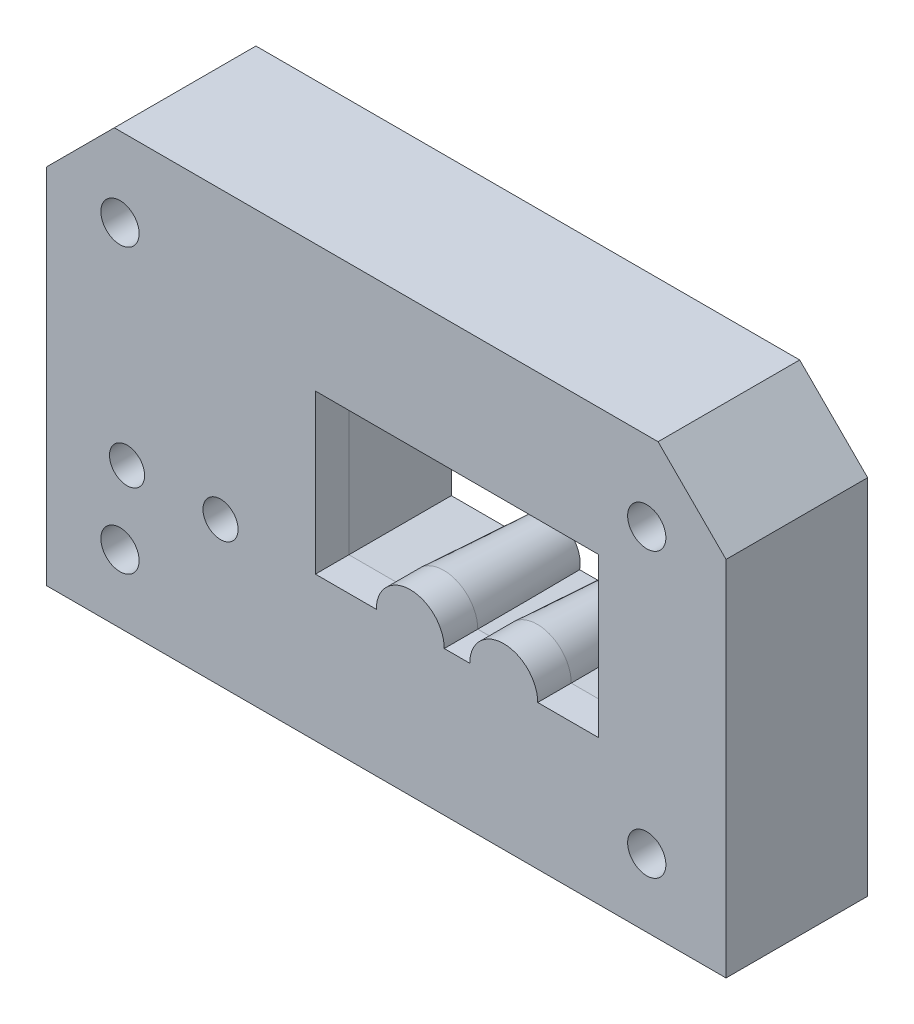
SolidWorks part; units mm, degrees
ref_plane "Face" through (0, 0, 0) normal (0, 0, 1) x (1, 0, 0)
ref_plane "Dessus" through (0, 0, 0) normal (0, 1, 0) x (1, 0, 0)
ref_plane "Droite" through (0, 0, 0) normal (1, 0, 0) x (0, 0, -1)
sketch "Esquisse1" plane through (0, 0, 0) normal (0, 0, 1) x (1, 0, 0)
  line L0 (313, 199) -> (217, 199) construction
  line L1 (325, 199) -> (205, 199)
  line L2 (325, 18) -> (325, 187) construction
  line L3 (325, 123) -> (325, 199)
  line L4 (325, 123) -> (205, 123)
  line L5 (205, 123) -> (205, 199)
  line L6 (263.25, 148.5) -> (241.75, 148.5) construction
  line L7 (279.75, 148.5) -> (275.25, 148.5) construction
  line L8 (302.5, 157.5) -> (302.5, 148.5) construction
  line L9 (302.5, 148.5) -> (291.75, 148.5) construction
  line L10 (263.25, 148.5) -> (252.5, 148.5)
  line L11 (279.75, 148.5) -> (275.25, 148.5)
  line L12 (302.5, 176.5) -> (302.5, 148.5)
  line L13 (302.5, 148.5) -> (291.75, 148.5)
  line L14 (302.5, 176.5) -> (252.5, 176.5)
  line L15 (252.5, 176.5) -> (252.5, 148.5)
  arc A0 (275.25, 148.5) -> (263.25, 148.5) centre (269.25, 148.5) ccw construction
  arc A1 (291.75, 148.5) -> (279.75, 148.5) centre (285.75, 148.5) ccw construction
  arc A2 (275.25, 148.5) -> (263.25, 148.5) centre (269.25, 148.5) ccw
  arc A3 (291.75, 148.5) -> (279.75, 148.5) centre (285.75, 148.5) ccw
  circle A4 centre (219.25, 148.5) radius 3.1
  circle A5 centre (235.75, 148.5) radius 3.1
  dimension "D5" = 6.2
  dimension "D6" = 6.2
  dimension "D8" = 16.75
  dimension "D1" = 76
  dimension "D2" = 120
  dimension "D3" = 28
  dimension "D4" = 50
  dimension "D7" = 22.5
extrude "Base-Extrusion" add sketch "Esquisse1" along normal blind 25
chamfer "Chanfrein1" distance 12 angle 45 2 edges at (205, 199, 12.5) (325, 199, 12.5)
sketch "Esquisse2" plane through (0, 0, 0) normal (0, 0, -1) x (-1, 0, 0)
  line L12 (-264.351, 147.5) -> (-251.5, 147.5)
  line L13 (-280.851, 147.5) -> (-274.149, 147.5)
  line L14 (-303.5, 147.5) -> (-290.649, 147.5)
  line L15 (-303.5, 177.5) -> (-303.5, 147.5)
  line L16 (-251.5, 177.5) -> (-303.5, 177.5)
  line L17 (-251.5, 147.5) -> (-251.5, 177.5)
  line L18 (-264.351, 147.5) -> (-251.5, 147.5)
  line L19 (-280.851, 147.5) -> (-274.149, 147.5)
  line L20 (-303.5, 147.5) -> (-290.649, 147.5)
  line L21 (-303.5, 177.5) -> (-303.5, 147.5)
  line L22 (-251.5, 177.5) -> (-303.5, 177.5)
  line L23 (-251.5, 147.5) -> (-251.5, 177.5)
  arc A4 (-264.351, 147.5) -> (-274.149, 147.5) centre (-269.25, 148.5) ccw
  arc A5 (-280.851, 147.5) -> (-290.649, 147.5) centre (-285.75, 148.5) ccw
  arc A6 (-264.351, 147.5) -> (-274.149, 147.5) centre (-269.25, 148.5) ccw
  arc A7 (-280.851, 147.5) -> (-290.649, 147.5) centre (-285.75, 148.5) ccw
  circle A8 centre (-235.75, 148.5) radius 4.1
  circle A9 centre (-235.75, 148.5) radius 4.1
  circle A11 centre (-219.25, 148.5) radius 4.1
  circle A12 centre (-219.25, 148.5) radius 4.1
  dimension "D1" = 1
  dimension "D2" = 1
  dimension "D3" = 1
extrude "Enlèv. mat.-Extru.1" cut sketch "Esquisse2" against normal through all draft 3
sketch "Esquisse3" plane through (0, 0, 0) normal (0, 0, -1) x (-1, 0, 0)
  line L0 (-325, 123) -> (-325, 187) construction
  line L1 (-205, 123) -> (-325, 123) construction
  circle A0 centre (-311, 135) radius 3.375
  dimension "D1" = 6.75
  dimension "D2" = 14
  dimension "D3" = 12
extrude "Enlèv. mat.-Extru.2" cut sketch "Esquisse3" against normal through all
pattern_linear "Répétition linéaire1" count 2 spacing 93 along (-1, 0, 0) count 2 spacing 50 along (0, 1, 0) of "Enlèv. mat.-Extru.2"
sketch "Esquisse4" plane through (0, 0, 25) normal (0, 0, 1) x (1, 0, 0)
  line L1 (275.25, 148.5) -> (279.75, 148.5)
  line L2 (275.25, 148.5) -> (275.25, 141.75)
  line L4 (279.75, 148.5) -> (279.75, 141.75)
  arc A0 (275.25, 141.75) -> (279.75, 141.75) centre (277.5, 141.75) ccw
  arc A1 (291.75, 148.5) -> (279.75, 148.5) centre (285.75, 148.5) ccw construction
  dimension "D1" = 6.75
  dimension "D2" = 2.25
extrude "Enlèv. mat.-Extru.3" cut sketch "Esquisse4" against normal up to vertex
sketch "Esquisse5" plane through (0, 0, 19.0811) normal (0, 0, 1) x (1, 0, 0)
  line L3 (275.25, 148.5) -> (275.25, 141.75)
  line L4 (279.75, 141.75) -> (279.75, 148.5)
  line L5 (279.75, 148.5) -> (275.25, 148.5)
  line L6 (275.25, 148.5) -> (275.25, 141.75)
  line L7 (279.75, 141.75) -> (279.75, 148.5)
  line L8 (279.75, 148.5) -> (275.25, 148.5)
  arc A1 (275.25, 141.75) -> (279.75, 141.75) centre (277.5, 141.75) ccw
  arc A2 (275.25, 141.75) -> (279.75, 141.75) centre (277.5, 141.75) ccw
  dimension "D1" = 0
extrude "Enlèv. mat.-Extru.4" cut sketch "Esquisse5" against normal through all draft 3
